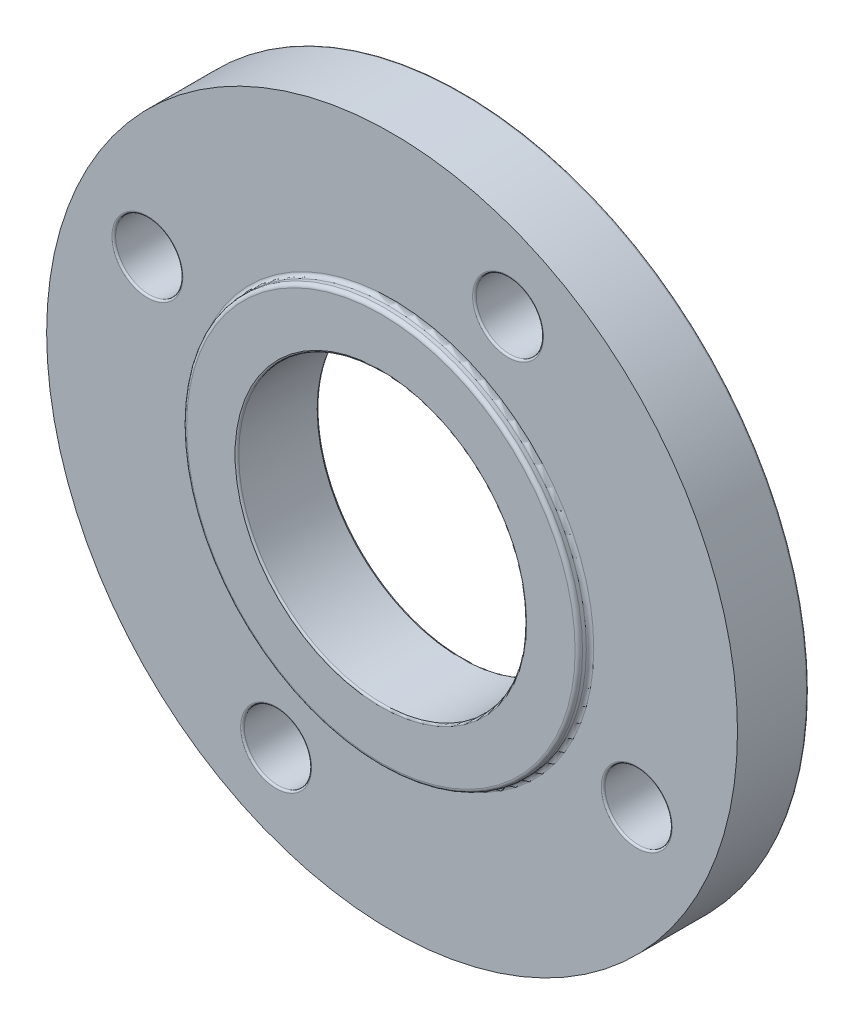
SolidWorks part; units mm, degrees
ref_plane "Plan de face" through (0, 0, 0) normal (0, 0, 1) x (1, 0, 0)
ref_plane "Plan de dessus" through (0, 0, 0) normal (0, 1, 0) x (1, 0, 0)
ref_plane "Plan de droite" through (0, 0, 0) normal (1, 0, 0) x (0, 0, -1)
sketch "Esquisse1" plane through (0, 0, 0) normal (0, 0, 1) x (1, 0, 0)
  circle A0 centre (0, 0) radius 38.55
  circle A1 centre (0, 0) radius 92.5
  dimension "D1" = 77.1
  dimension "D2" = 185
extrude "Extrusion1" add sketch "Esquisse1" along normal blind 22
fillet "Congé1" radius 0.5 4 edges at (38.55, 0, 0) (38.55, 0, 22) (92.5, 0, 0) (92.5, 0, 22)
sketch "Esquisse2" plane through (0, 0, 22) normal (0, 0, 1) x (1, 0, 0)
  circle A0 centre (0, 0) radius 53.0123
  circle A1 centre (0, 0) radius 121.8046
extrude "Extrusion2" cut sketch "Esquisse2" against normal blind 3
fillet "Congé2" radius 1 2 edges at (53.0123, 0, 19) (53.0123, 0, 22)
sketch "Esquisse3" plane through (0, 0, 19) normal (0, 0, 1) x (1, 0, 0)
  circle A2 centre (65.5135, -31.0521) radius 9
  circle A4 centre (-31.0521, -65.5135) radius 9
  circle A6 centre (-65.5135, 31.0521) radius 9
  circle A8 centre (31.0521, 65.5135) radius 9
  circle A9 centre (68.2822, 24.3679) radius 9
  circle A10 centre (24.3679, -68.2822) radius 9
  circle A11 centre (-68.2822, -24.3679) radius 9
  circle A12 centre (-24.3679, 68.2822) radius 9
  dimension "D1" = 145
extrude "Extrusion3" cut sketch "Esquisse3" against normal through all
fillet "Congé3" radius 0.5 8 edges at (-22.0521, -65.5135, 19) (-22.0521, -65.5135, 0) (74.5135, -31.0521, 19) (74.5135, -31.0521, 0) (40.0521, 65.5135, 0) (40.0521, 65.5135, 19) (-56.5135, 31.0521, 0) (-56.5135, 31.0521, 19)
ref_plane "Plan1" through (0, 0, 0) normal (1, 0, 0) x (0, 0, -1)
